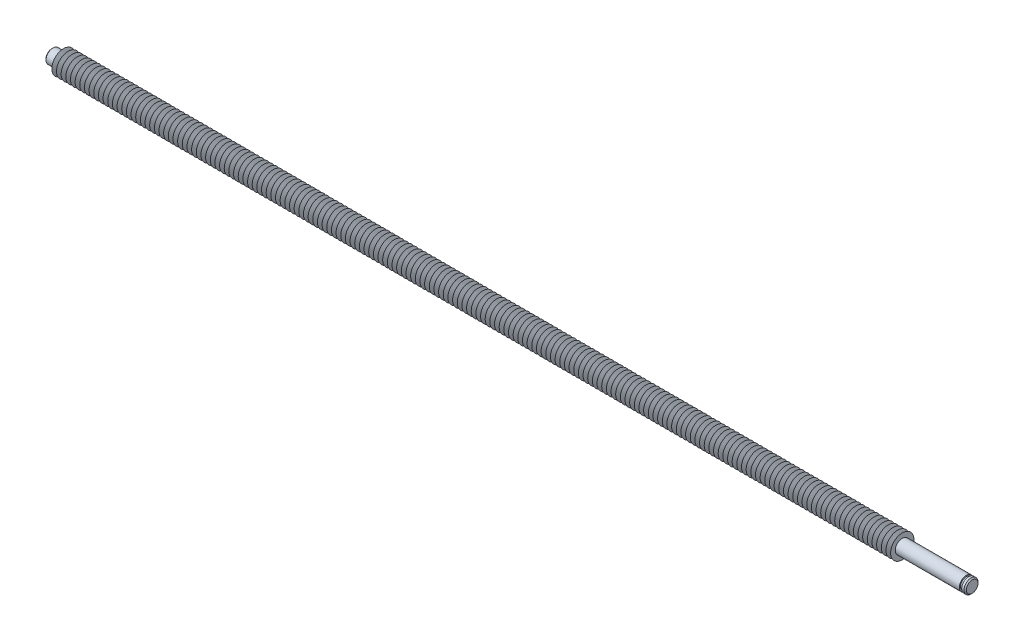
SolidWorks part; units mm, degrees
ref_plane "Plane1" through (0, 0, 0) normal (0, 0, 1) x (1, 0, 0)
ref_plane "Plane2" through (0, 0, 0) normal (0, 1, 0) x (1, 0, 0)
ref_plane "Plane3" through (0, 0, 0) normal (1, 0, 0) x (0, 0, -1)
sketch "Esquisse9" plane through (0, 0, 0) normal (0, 0, 1) x (1, 0, 0)
  line L0 (0, 0) -> (-1, 2)
  line L1 (-5, -3) -> (7, -3) construction
  line L2 (0, 0) -> (1, 2)
  line L3 (1, 2) -> (1, -3)
  line L5 (1, -3) -> (-1, -3)
  line L9 (-1, 2) -> (-1, -3)
revolve "Base-Révolution" add sketch "Esquisse9" angle 360 about L1
pattern_linear "Répétition linéaire4" count 180 spacing 2 along (1, 0, 0)
sketch "Esquisse13" plane through (-1, 0, 0) normal (-1, 0, 0) x (0, 0, 1)
  circle A0 centre (0, -3) radius 3
  dimension "D1" = 6
extrude "Boss.-Extru.6" add sketch "Esquisse13" along normal blind 5
chamfer "Chanfrein3" distance 0.5 angle 45
sketch "Esquisse15" plane through (359, 0, 0) normal (1, 0, 0) x (0, 0, -1)
  circle A0 centre (0, -3) radius 3
  dimension "D1" = 6
extrude "Boss.-Extru.7" add sketch "Esquisse15" along normal blind 27.5
sketch "Esquisse16" plane through (386.5, 0, 0) normal (1, 0, 0) x (0, 0, -1)
  circle A0 centre (0, -3) radius 2.5
  dimension "D1" = 5
extrude "Boss.-Extru.8" add sketch "Esquisse16" along normal blind 1
sketch "Esquisse17" plane through (387.5, 0, 0) normal (1, 0, 0) x (0, 0, -1)
  circle A0 centre (0, -3) radius 3
extrude "Boss.-Extru.9" add sketch "Esquisse17" along normal blind 1.5
chamfer "Chanfrein4" distance 0.5 angle 45
